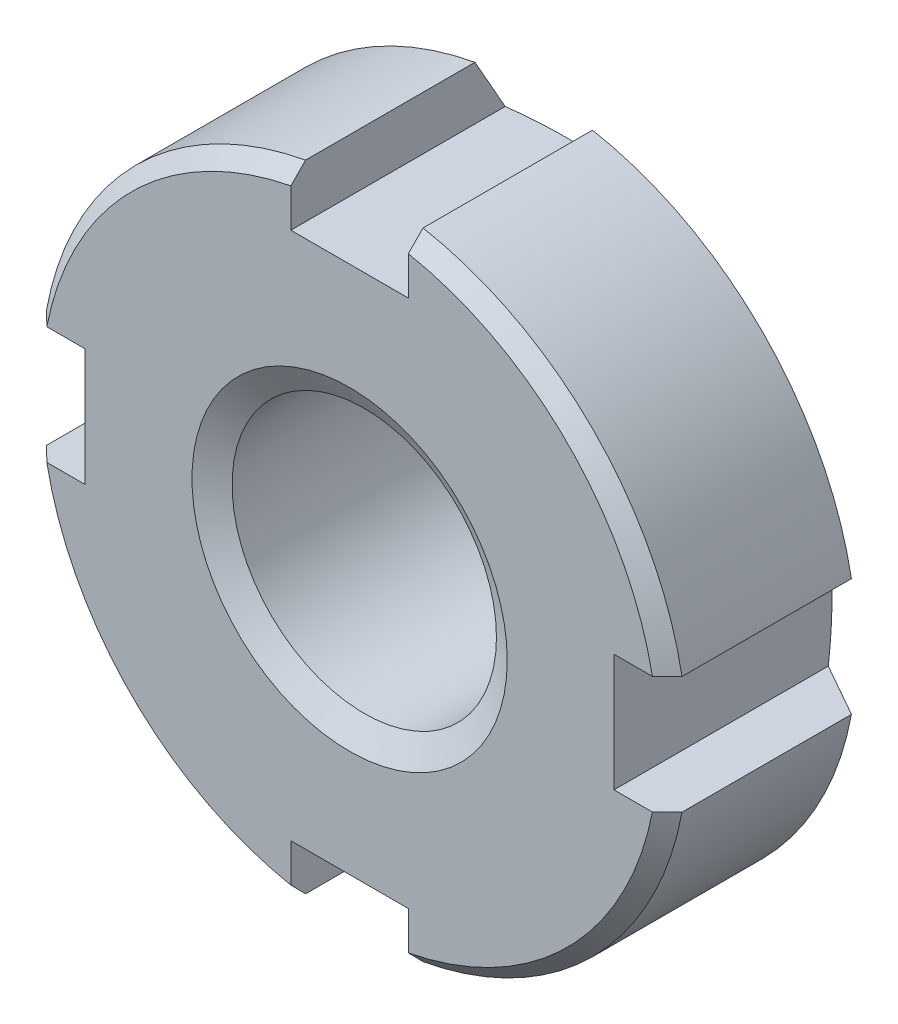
SolidWorks part; units mm, degrees
ref_plane "Front" through (0, 0, 0) normal (0, 0, 1) x (1, 0, 0)
ref_plane "Top" through (0, 0, 0) normal (0, 1, 0) x (1, 0, 0)
ref_plane "Right" through (0, 0, 0) normal (1, 0, 0) x (0, 0, -1)
sketch "Sketch1" plane through (0, 0, 0) normal (0, 0, 1) x (1, 0, 0)
  circle A0 centre (0, 0) radius 11
  circle A1 centre (0, 0) radius 4.5
  dimension "dk" = 22
  dimension "D" = 9
extrude "BaseNut" add sketch "Sketch1" against normal blind 8
sketch "Sketch2" plane through (0, 0, 0) normal (0, 1, 0) x (1, 0, 0)
  line L0 (-11, 8) -> (-8, 8)
  line L2 (-8, 8) -> (-11, 6.2679)
  line L3 (-11, 6.2679) -> (-11, 8)
  line L4 (0, 4.5605) -> (0, -11.63) construction
  line L7 (11, 8) -> (-11, 8) construction
  line L8 (-11, 8) -> (-11, 0) construction
  dimension "d1" = 16
  dimension "Angle" = 30
revolve "StepCut" cut sketch "Sketch2" angle 360 about L4
chamfer "Chamfer1" distance 0.5 angle 45 1 edges at (11, 0, 0)
chamfer "EndChamfer" distance 0.5 angle 60 1 edges at (4.5, 0, 0)
chamfer "Chamfer2" distance 0.7 angle 45 1 edges at (4.5, 0, -8)
sketch "Sketch3" plane through (-3.5543, 4.131, -8) normal (0, 0, -1) x (-1, 0, 0)
  line L0 (-5.5543, -13.131) -> (-1.5543, -13.131)
  line L1 (-1.5543, -13.131) -> (-1.5543, -14.9477)
  line L3 (-5.5543, -14.9477) -> (-5.5543, -13.131)
  circle A0 centre (-3.5543, -4.131) radius 11 construction
  arc A1 (-5.5543, -14.9477) -> (-1.5543, -14.9477) centre (-3.5543, -4.131) ccw
  dimension "n1" = 2
  dimension "n" = 4
  dimension "t" = 2
extrude "SlotCut" cut sketch "Sketch3" against normal through all
pattern_circular "SlotPat" count 4 over 360 about axis through (0, 0, -4.5605) along (0, 0, 1) of "SlotCut"
sketch "Sketch4" plane through (0, 0, 0) normal (1, 0, 0) x (0, 0, -1)
  line L0 (16.8557, 0) -> (-7.8489, 0) construction
  line L1 (7.05, 4) -> (7.55, 4)
  line L2 (7.55, 4) -> (7.55, 4.5)
  line L3 (7.55, 4.5) -> (7.3, 4.933)
  line L4 (7.3, 4.933) -> (7.05, 4.5)
  line L5 (7.05, 4.5) -> (7.05, 4)
  line L6 (7.3, -4.5) -> (7.3, 4.5) construction
  dimension "D1" = 0.5
  dimension "D2" = 9
revolve "Cut-Revolve10" [suppressed] cut sketch "Sketch4" angle 360 about L0
pattern_linear "LPattern10" [suppressed] count 13 spacing 0.6 along (0, 0, 1)
equation "\"n1@Sketch3\" = \"n@Sketch3\" / 2"
equation "\"D1@Chamfer2\" = \"C1@EndChamfer\" * 1.4"
equation "\"D1@Sketch4\" = (  \"D2@ThreadCosmetic1\" - \"D@Sketch1\" )  / 2"
equation "\"D2@Sketch4\" = \"D@Sketch1\""
equation "\"D3@LPattern10\" = \"D1@Sketch4\" * 1.2"
equation "\"D1@LPattern10\" = \"m@BaseNut\" / \"D3@LPattern10\""
